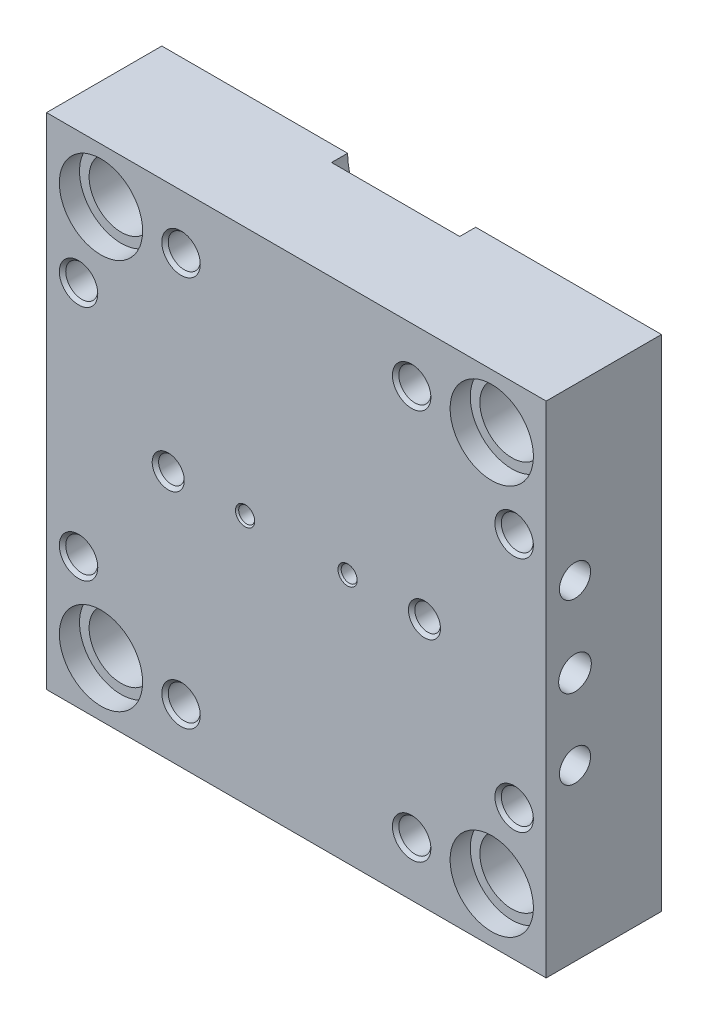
SolidWorks part; units mm, degrees
ref_plane "Plan de face" through (0, 0, 0) normal (0, 0, 1) x (1, 0, 0)
ref_plane "Plan de dessus" through (0, 0, 0) normal (0, 1, 0) x (1, 0, 0)
ref_plane "Plan de droite" through (0, 0, 0) normal (1, 0, 0) x (0, 0, -1)
sketch "Esquisse1" plane through (0, 0, 0) normal (0, 0, 1) x (1, 0, 0)
  line L1 (-78, 78) -> (78, 78)
  line L2 (-78, 78) -> (-78, -78)
  line L3 (-78, -78) -> (78, -78)
  line L4 (78, 78) -> (78, -78)
  point P4 (0, 78)
  point P6 (-78, 0)
  dimension "D1" = 156
  dimension "D2" = 156
extrude "Extrusion1" add sketch "Esquisse1" along normal blind 36
sketch "Esquisse2" plane through (0, 0, 0) normal (0, 0, 1) x (1, 0, 0)
  circle A0 centre (-61, 61) radius 10
  dimension "D1" = 20
  dimension "D3" = 61
  dimension "D2" = 61
extrude "Enlèv. mat.-Extru.2" cut sketch "Esquisse2" along normal through all
sketch "Esquisse3" plane through (0, 0, 36) normal (0, 0, 1) x (1, 0, 0)
  circle A0 centre (-61, 61) radius 13
  dimension "D1" = 26
extrude "Enlèv. mat.-Extru.3" cut sketch "Esquisse3" against normal blind 6.3
hole_wizard "Trou taraudé M10x1.51" positions "Esquisse7" profile "Esquisse6" tap size "M10x1.5" standard "Ansi Métrique"
sketch "Esquisse7" plane through (0, 0, 36) normal (0, 0, 1) x (1, 0, 0)
  point P0 (-36, 61)
  dimension "D1" = 61
  dimension "D2" = 36
sketch "Esquisse6" plane through (-36, 61, 36) normal (1, 0, 0) x (0, -1, 0)
  line L0 (0, 0) -> (0, 22.5537)
  line L1 (0, 22.5537) -> (4.25, 20)
  line L2 (4.25, 20) -> (4.25, 15)
  line L3 (4.25, 15) -> (5, 15)
  line L4 (5, 15) -> (5, 0)
  line L5 (5, 0) -> (0, 0)
  line L10 (0, 22.5537) -> (-4.25, 20) construction
  line L11 (0, -6.35) -> (0, 107.95) construction
  dimension "Diamètre du trou pour taraudage" = 8.5
  dimension "Profondeur du trou pour taraudage" = 20
  dimension "Diamètre principal du filetage" = 10
  dimension "Profondeur du filetage" = 15
  dimension "Angle de pointe" = 118
mirror "Symétrie1" about plane through (0, 0, 0) normal (1, 0, 0) of "Enlèv. mat.-Extru.3", "Enlèv. mat.-Extru.2", "Trou taraudé M10x1.51"
mirror "Symétrie2" about plane through (0, 0, 0) normal (0, 1, 0) of "Symétrie1", "Enlèv. mat.-Extru.2", "Enlèv. mat.-Extru.3", "Trou taraudé M10x1.51"
sketch "Esquisse8" plane through (0, 0, 0) normal (0, 0, -1) x (-1, 0, 0)
  line L0 (0, 0) -> (-19.3743, 0) construction
  line L1 (-25, 2.5) -> (25, 2.5)
  line L3 (-25, -2.5) -> (25, -2.5)
  arc A0 (25, 2.5) -> (25, -2.5) centre (25, 0) cw
  arc A1 (-25, 2.5) -> (-25, -2.5) centre (-25, 0) ccw
  point P4 (0, 2.5)
  dimension "D1" = 50
  dimension "D2" = 5
extrude "canal d'injection" cut sketch "Esquisse8" against normal blind 4
fillet "Congé1" radius 2.5 4 edges at (0, 2.5, 4) (-27.5, 0, 4) (0, -2.5, 4) (27.5, 0, 4)
sketch "Esquisse9" plane through (0, 0, 0) normal (0, 0, -1) x (-1, 0, 0)
  line L0 (-78, 78) -> (78, 78) construction
  line L1 (78, -78) -> (-78, -78) construction
  line L2 (-20, 78) -> (20, 78)
  line L3 (-20, -78) -> (20, -78)
  arc A0 (-20, 78) -> (20, 78) centre (0, 78) ccw
  arc A1 (20, -78) -> (-20, -78) centre (0, -78) ccw
  dimension "D1" = 20
  dimension "D2" = 20
extrude "passage pinces" cut sketch "Esquisse9" against normal blind 5
sketch "Esquisse10" plane through (0, 0, 0) normal (0, 0, -1) x (-1, 0, 0)
  line L0 (-25, 0) -> (25, 0) construction
  line L1 (0, 78) -> (0, -78) construction
  line L2 (20, 78) -> (-20, 78) construction
  line L3 (-20, -78) -> (20, -78) construction
  line L5 (78, 78) -> (78, -78) construction
  line L6 (78, 0) -> (-78, 0) construction
  line L7 (-78, -78) -> (-78, 78) construction
  circle A0 centre (-40, 0) radius 4
  circle A1 centre (-68, 37) radius 5
  circle A4 centre (40, 0) radius 4
  circle A5 centre (68, 37) radius 5
  circle A6 centre (68, -37) radius 5
  circle A7 centre (-68, -37) radius 5
  circle A9 centre (-16, 0) radius 2
  circle A10 centre (16, 0) radius 2
  dimension "D2" = 40
  dimension "D3" = 10
  dimension "D4" = 68
  dimension "D5" = 16
  dimension "D6" = 8
  dimension "D7" = 8
  dimension "D11" = 40
  dimension "D12" = 37
  dimension "D17" = 4
  dimension "D13" = 136
  dimension "D16" = 16
  dimension "D14" = 74
extrude "Enlèv. mat.-Extru.6" cut sketch "Esquisse10" against normal through all
hole_wizard "Trou taraudé M12x1.751" positions "Esquisse16" profile "Esquisse15" tap size "M12x1.75" standard "Ansi Metric"
sketch "Esquisse16" plane through (78, 0, 0) normal (1, 0, 0) x (0, 0, -1)
  line L0 (0, -78) -> (0, 78) construction
  point P0 (-27, 0)
  dimension "D1" = 27
sketch "Esquisse15" plane through (78, 0, 27) normal (0, 1, 0) x (0, 0, -1)
  line L0 (0, 0) -> (0, 28.0644)
  line L1 (0, 28.0644) -> (5.1, 25)
  line L2 (5.1, 25) -> (5.1, 0)
  line L5 (5.1, 0) -> (0, 0)
  line L10 (0, 28.0644) -> (-5.1, 25) construction
  line L11 (0, -6.35) -> (0, 107.95) construction
  dimension "Diamètre du trou pour taraudage" = 10.2
  dimension "Profondeur du trou pour taraudage" = 25
  dimension "Angle de pointe" = 118
hole_wizard "Trou taraudé 1/8 Rc1" positions "Esquisse18" profile "Esquisse17" size "1/8" standard "ISO"
sketch "Esquisse18" plane through (-78, 0, 0) normal (-1, 0, 0) x (0, 0, 1)
  line L0 (0, 78) -> (0, -78) construction
  point P0 (27, 25)
  point P2 (27, -25)
  point P5 (0, 0)
  dimension "D1" = 50
  dimension "D2" = 25
  dimension "D3" = 27
sketch "Esquisse17" plane through (-78, 25, 27) normal (0, 1, 0) x (0, 0, 1)
  line L0 (0, 0) -> (0, 14.3134)
  line L1 (3.95, 11.94) -> (0, 14.3134)
  line L2 (-3.95, 11.94) -> (0, 14.3134) construction
  line L3 (3.95, 11.94) -> (3.95, 7.4)
  line L4 (3.95, 7.4) -> (4.633, 7.4)
  line L5 (4.633, 7.4) -> (4.864, 0)
  line L6 (-4.633, 7.4) -> (-4.864, 0) construction
  line L7 (4.864, 0) -> (0, 0)
  line L8 (0, -6.35) -> (0, 107.95) construction
  line L11 (-3.95, 7.4) -> (-4.633, 7.4) construction
  dimension "Diamètre du trou pour taraudage" = 7.9
  dimension "Profondeur du trou pour taraudage" = 11.94
  dimension "Diamètre du filetage" = 9.728
  dimension "Angle de filetage" = 3.576
  dimension "Profondeur du filetage" = 7.4
  dimension "Angle de pointe" = 118
mirror "Symétrie3" about plane through (0, 0, 0) normal (1, 0, 0) of "Trou taraudé 1/8 Rc1"
sketch "Esquisse19" plane through (-78, 0, 0) normal (-1, 0, 0) x (0, 0, 1)
  circle A0 centre (27, 25) radius 3.5
  circle A1 centre (27, -25) radius 3.5
  dimension "D1" = 7
extrude "Enlèv. mat.-Extru.11" cut sketch "Esquisse19" against normal through all
sketch "Esquisse20" plane through (0, 0, 0) normal (0, 1, 0) x (1, 0, 0)
  line L0 (-16, 0) -> (-16, -42.3966) construction
  line L1 (20, 0) -> (-20, 0) construction
  line L2 (-18, -4) -> (-18, -36) construction
  line L3 (-14, -36) -> (-14, -4) construction
  line L4 (-18.25, 0) -> (-18.5907, -6.5)
  line L5 (-18.5907, -6.5) -> (-16, -6.5)
  line L6 (-16, -6.5) -> (-16, 0)
  line L7 (-16, 0) -> (-18.25, 0)
  line L8 (-18, -4) -> (-25, -4) construction
  dimension "D1" = 4.5
  dimension "D2" = 3
  dimension "D3" = 2.5
revolve "Enlèvement de matière-Révolution1" cut sketch "Esquisse20" angle 360 about L0
mirror "Symétrie5" about plane through (0, 0, 0) normal (1, 0, 0) of "Enlèvement de matière-Révolution1"
chamfer "Chanfrein1" distance 1 angle 45 12 edges at (-18, 0, 36) (14, 0, 36) (-44, 0, 36) (36, 0, 36) (-31, -61, 36) (41, -61, 36) (-31, 61, 36) (41, 61, 36) (63, -37, 36) (-73, -37, 36) (-73, 37, 36) (63, 37, 36)
sketch "Esquisse21" plane through (0, 0, 36) normal (0, 0, 1) x (1, 0, 0)
  circle A0 centre (16, 0) radius 2.5
  circle A1 centre (-16, 0) radius 2.5
  dimension "D1" = 5
extrude "Enlèv. mat.-Extru.12" cut sketch "Esquisse21" against normal blind 20
sketch "Esquisse22" plane through (0, 0, 0) normal (0, 0, -1) x (-1, 0, 0)
  circle A0 centre (40, 0) radius 11
  dimension "D1" = 22
extrude "Enlèv. mat.-Extru.13" cut sketch "Esquisse22" against normal blind 2
sketch "Esquisse23" plane through (0, 0, 2) normal (0, 0, -1) x (-1, 0, 0)
  circle A0 centre (40, 0) radius 5.5
  dimension "D1" = 11
extrude "Enlèv. mat.-Extru.14" cut sketch "Esquisse23" against normal blind 0.5
sketch "Esquisse24" plane through (0, 0, 0) normal (0, 0, -1) x (-1, 0, 0)
  line L0 (27.5, 0) -> (29, 0) construction
  line L1 (25, -2.5) -> (25, 0) construction
  line L2 (32.567, -1) -> (25, -1)
  line L3 (32.567, -1) -> (32.567, 1)
  line L4 (32.567, 1) -> (25, 1)
  line L5 (25, -1) -> (25, 1)
  arc A0 (25, -2.5) -> (25, 2.5) centre (25, 0) ccw construction
  circle A1 centre (40, 0) radius 11 construction
  circle A2 centre (40, 0) radius 7.5 construction
  dimension "D1" = 2
extrude "Enlèv. mat.-Extru.15" cut sketch "Esquisse24" against normal blind 0.5
mirror "Symétrie6" about plane through (0, 0, 0) normal (1, 0, 0) of "Enlèv. mat.-Extru.15", "Enlèv. mat.-Extru.13", "Enlèv. mat.-Extru.14"
